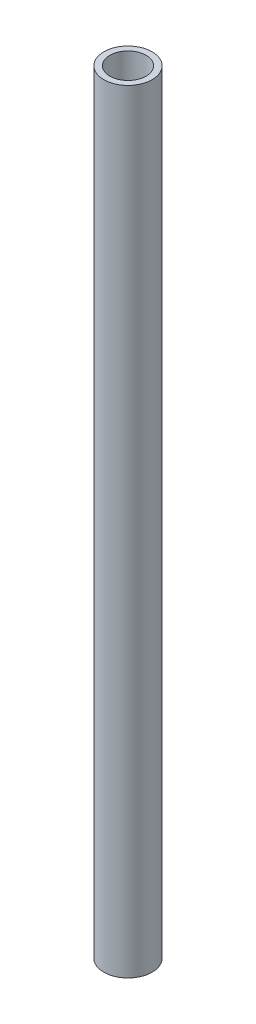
SolidWorks part; units mm, degrees
ref_plane "Front Plane" through (0, 0, 0) normal (0, 0, 1) x (1, 0, 0)
ref_plane "Top Plane" through (0, 0, 0) normal (0, 1, 0) x (1, 0, 0)
ref_plane "Right Plane" through (0, 0, 0) normal (1, 0, 0) x (0, 0, -1)
sketch "Sketch2" plane through (0, 0, 0) normal (0, 1, 0) x (1, 0, 0)
  circle A0 centre (0, 0) radius 3.175
  circle A1 centre (0, 0) radius 2.3812
  dimension "D1" = 6.35
  dimension "D2" = 4.7625
extrude "Extrude1" add sketch "Sketch2" along normal blind 101.6
